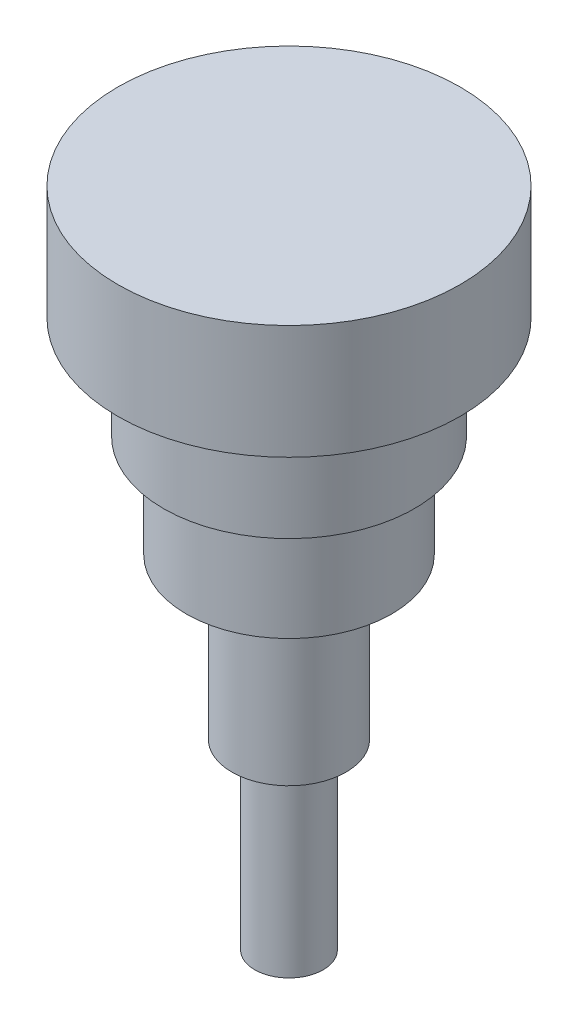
SolidWorks part; units mm, degrees
ref_plane "前视基准面" through (0, 0, 0) normal (0, 0, 1) x (1, 0, 0)
ref_plane "上视基准面" through (0, 0, 0) normal (0, 1, 0) x (1, 0, 0)
ref_plane "右视基准面" through (0, 0, 0) normal (1, 0, 0) x (0, 0, -1)
sketch "草图2" plane through (0, 0, 0) normal (0, 0, 1) x (1, 0, 0)
  line L0 (0, 128) -> (0, 87.8534) construction
  line L1 (10.5, 128) -> (-10.5, 128) construction
  line L2 (0, 98) -> (-3, 98)
  line L3 (-3, 99.8496) -> (-3, 96) construction
  line L4 (-3, 98) -> (-3, 114)
  line L5 (-3, 114) -> (-5, 114)
  line L6 (-5, 114) -> (-5, 128)
  line L7 (-5, 128) -> (-9, 128)
  line L8 (-9, 128) -> (-9, 137)
  line L9 (-9, 137) -> (-11, 137)
  line L10 (-11, 137) -> (-11, 146)
  line L11 (-15, 146) -> (-11, 146)
  line L12 (-15, 146) -> (-15, 156)
  line L14 (-15, 156) -> (0, 156)
  line L15 (0, 156) -> (0, 98)
  line L16 (5, 128) -> (-5, 128) construction
  dimension "D1" = 9
  dimension "D2" = 9
  dimension "D3" = 11
  dimension "D4" = 15
  dimension "D5" = 28
  dimension "D6" = 10
  dimension "D7" = 30
revolve "旋转1" add sketch "草图2" angle 360 about L0
